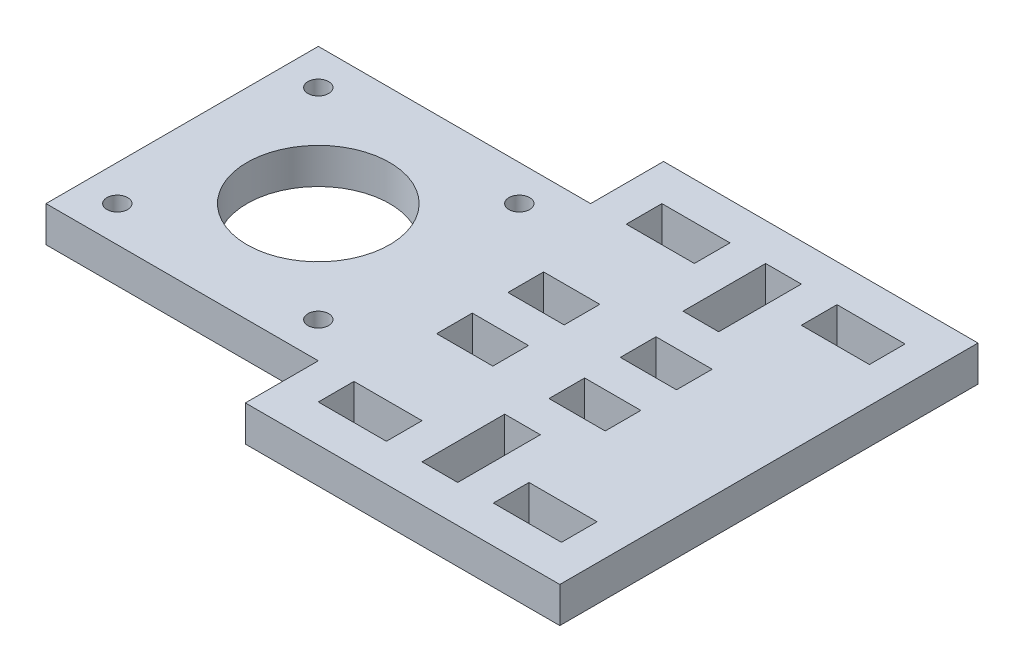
SolidWorks part; units mm, degrees
ref_plane "Front Plane" through (0, 0, 0) normal (0, 0, 1) x (1, 0, 0)
ref_plane "Top Plane" through (0, 0, 0) normal (0, 1, 0) x (1, 0, 0)
ref_plane "Right Plane" through (0, 0, 0) normal (1, 0, 0) x (0, 0, -1)
sketch "Sketch1" plane through (0, 0, 0) normal (0, 1, 0) x (1, 0, 0)
  line L0 (0, 0) -> (-43, 0) construction
  line L1 (0, 64.5) -> (-43, 64.5) construction
  line L2 (-43, 64.5) -> (-43, 0) construction
  line L3 (0, 64.5) -> (0, 0) construction
  line L4 (-43, 0) -> (-48.5, 0) construction
  line L5 (-48.5, 53.25) -> (-90.5, 53.25) construction
  line L6 (-48.5, 64.5) -> (-43, 64.5) construction
  line L7 (-43, 53.25) -> (-43, 11.25) construction
  line L8 (-90.5, 53.25) -> (-90.5, 11.25) construction
  line L9 (-90.5, 11.25) -> (-48.5, 11.25) construction
  line L10 (-48.5, 11.25) -> (-48.5, 53.25) construction
  line L11 (-48.5, 53.25) -> (-90.5, 11.25) construction
  line L12 (-43, 64.5) -> (-43, 58.75) construction
  line L13 (-5.5, 64.5) -> (-5.5, 0) construction
  line L14 (-43, 58.75) -> (-5.5, 58.75) construction
  line L15 (-43, 0) -> (-43, 5.75) construction
  line L16 (-43, 5.75) -> (-5.5, 5.75) construction
  line L17 (-43, 58.75) -> (-43, 53.25) construction
  line L18 (-21.5, 5.75) -> (-27, 5.75) construction
  line L19 (-27, 5.75) -> (-27, 18.5) construction
  line L20 (-27, 58.75) -> (-21.5, 58.75) construction
  line L21 (-21.5, 58.75) -> (-21.5, 46) construction
  line L22 (-27, 5.75) -> (-32.5, 5.75) construction
  line L23 (-32.5, 5.75) -> (-32.5, 11.25) construction
  line L24 (-21.5, 58.75) -> (-16, 58.75) construction
  line L25 (-16, 58.75) -> (-16, 53.25) construction
  line L26 (-43, 53.25) -> (-32.5, 53.25) construction
  line L27 (-16, 53.25) -> (-5.5, 53.25) construction
  line L28 (-43, 5.75) -> (-43, 11.25) construction
  line L29 (-43, 29.5) -> (-43, 24) construction
  line L30 (-17, 29.5) -> (-43, 29.5) construction
  line L31 (-17, 35) -> (-43, 35) construction
  line L32 (-43, 35) -> (-43, 40.5) construction
  line L33 (-43, 40.5) -> (-17, 40.5) construction
  line L34 (-17, 40.5) -> (-17, 35) construction
  line L35 (-43, 24) -> (-17, 24) construction
  line L36 (-17, 24) -> (-17, 29.5) construction
  line L37 (-43, 5.75) -> (-43, 11.25) construction
  line L38 (-43, 5.75) -> (-43, 11.25) construction
  line L39 (-43, 11.25) -> (-32.5, 11.25) construction
  line L40 (-90.5, 53.25) -> (-48.5, 11.25) construction
  line L41 (-21.5, 46) -> (-27, 46) construction
  line L42 (-21.5, 5.75) -> (-21.5, 18.5) construction
  line L43 (-21.5, 18.5) -> (-27, 18.5) construction
  line L44 (-16, 11.25) -> (-5.5, 11.25) construction
  line L45 (-16, 11.25) -> (-5.5, 11.25)
  line L46 (-25.6667, 40.5) -> (-34.3333, 40.5) construction
  line L47 (-34.3333, 40.5) -> (-34.3333, 35) construction
  line L48 (-32.5, 53.25) -> (-32.5, 58.75) construction
  line L49 (-17, 29.5) -> (-25.6667, 29.5) construction
  line L50 (-25.6667, 29.5) -> (-25.6667, 24) construction
  line L51 (-25.6667, 24) -> (-34.3333, 24) construction
  line L52 (-27, 46) -> (-27, 58.75) construction
  line L53 (-25.6667, 35) -> (-25.6667, 40.5) construction
  line L54 (-34.3333, 24) -> (-34.3333, 29.5) construction
  line L55 (-16, 11.25) -> (-16, 5.75) construction
  line L56 (-48.5, 64.5) -> (0, 64.5)
  line L57 (0, 64.5) -> (0, 0)
  line L58 (0, 0) -> (-48.5, 0)
  line L60 (-43, 58.75) -> (-32.5, 58.75)
  line L61 (-32.5, 58.75) -> (-32.5, 53.25)
  line L62 (-32.5, 53.25) -> (-43, 53.25)
  line L63 (-43, 53.25) -> (-43, 58.75)
  line L64 (-27, 58.75) -> (-27, 46)
  line L65 (-27, 46) -> (-21.5, 46)
  line L66 (-21.5, 46) -> (-21.5, 58.75)
  line L67 (-21.5, 58.75) -> (-27, 58.75)
  line L68 (-16, 58.75) -> (-5.5, 58.75)
  line L69 (-5.5, 58.75) -> (-5.5, 53.25)
  line L70 (-5.5, 53.25) -> (-16, 53.25)
  line L71 (-16, 53.25) -> (-16, 58.75)
  line L72 (-43, 40.5) -> (-34.3333, 40.5)
  line L73 (-34.3333, 40.5) -> (-34.3333, 35)
  line L74 (-34.3333, 35) -> (-43, 35)
  line L75 (-43, 35) -> (-43, 40.5)
  line L76 (-25.6667, 40.5) -> (-17, 40.5)
  line L77 (-17, 40.5) -> (-17, 35)
  line L78 (-17, 35) -> (-25.6667, 35)
  line L79 (-25.6667, 35) -> (-25.6667, 40.5)
  line L80 (-43, 29.5) -> (-34.3333, 29.5)
  line L81 (-34.3333, 29.5) -> (-34.3333, 24)
  line L82 (-34.3333, 24) -> (-43, 24)
  line L83 (-43, 24) -> (-43, 29.5)
  line L84 (-25.6667, 29.5) -> (-17, 29.5)
  line L85 (-17, 29.5) -> (-17, 24)
  line L86 (-17, 24) -> (-25.6667, 24)
  line L87 (-25.6667, 24) -> (-25.6667, 29.5)
  line L88 (-43, 11.25) -> (-32.5, 11.25)
  line L89 (-32.5, 11.25) -> (-32.5, 5.75)
  line L90 (-32.5, 5.75) -> (-43, 5.75)
  line L91 (-43, 5.75) -> (-43, 11.25)
  line L92 (-27, 5.75) -> (-27, 18.5)
  line L93 (-27, 18.5) -> (-21.5, 18.5)
  line L94 (-21.5, 18.5) -> (-21.5, 5.75)
  line L95 (-21.5, 5.75) -> (-27, 5.75)
  line L96 (-16, 5.75) -> (-16, 11.25)
  line L100 (-43, 64.5) -> (-48.5, 64.5) construction
  line L101 (-48.5, 64.5) -> (-48.5, 53.25) construction
  line L102 (-85, 47.75) -> (-54, 16.75) construction
  line L103 (-48.5, 11.25) -> (-48.5, 0) construction
  line L108 (-5.5, 11.25) -> (-5.5, 5.75)
  line L109 (-5.5, 5.75) -> (-16, 5.75)
  line L110 (-48.5, 64.5) -> (-48.5, 53.25)
  line L111 (-48.5, 53.25) -> (-90.5, 53.25)
  line L112 (-90.5, 53.25) -> (-90.5, 11.25)
  line L113 (-90.5, 11.25) -> (-48.5, 11.25)
  line L114 (-48.5, 11.25) -> (-48.5, 0)
  circle A5 centre (-69.5, 32.25) radius 11
  circle A6 centre (-85, 47.75) radius 1.6
  circle A7 centre (-54, 47.75) radius 1.6
  circle A8 centre (-85, 16.75) radius 1.6
  circle A9 centre (-54, 16.75) radius 1.6
  point P10 (-43, 32.25)
  point P14 (0, 64.5)
  point P24 (-24.25, 5.75)
  point P40 (-17, 35)
  point P44 (-17, 29.5)
  point P53 (-30, 40.5)
  point P56 (-21.5, 12.125)
  point P57 (-21.5, 52.375)
  point P62 (-69.5, 32.25)
  dimension "D3" = 12.75
  dimension "D7" = 10.5
  dimension "D1" = 64.5
  dimension "D2" = 37.5
  dimension "D4" = 26
  dimension "D5" = 40.25
  dimension "D8" = 53
  dimension "D9" = 8.6667
  dimension "D10" = 10.5
extrude "Boss-Extrude1" add sketch "Sketch1" along normal blind 5.5
